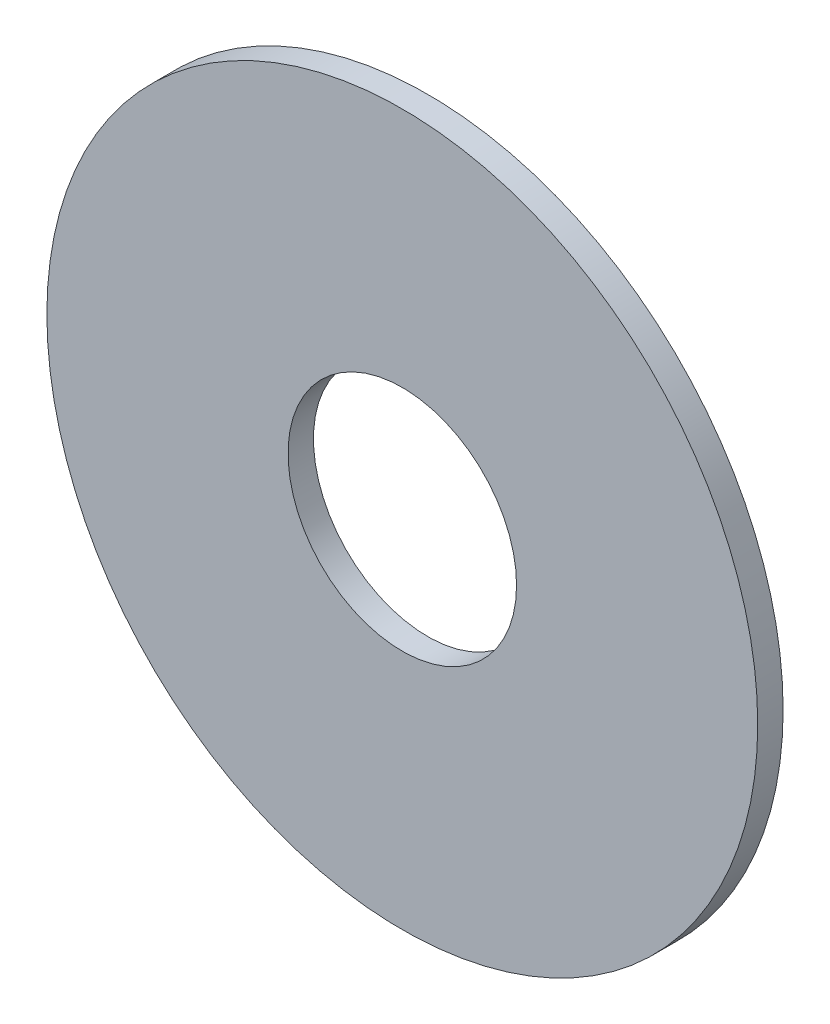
SolidWorks part; units mm, degrees
ref_plane "Front Plane" through (0, 0, 0) normal (0, 0, 1) x (1, 0, 0)
ref_plane "Top Plane" through (0, 0, 0) normal (0, 1, 0) x (1, 0, 0)
ref_plane "Right Plane" through (0, 0, 0) normal (1, 0, 0) x (0, 0, -1)
sketch "Sketch1" plane through (0, 0, 0) normal (0, 0, 1) x (1, 0, 0)
  circle A0 centre (0, 0) radius 88.9
  dimension "D1" = 177.8
extrude "Boss-Extrude1" add sketch "Sketch1" along normal blind 6.35
sketch "Sketch2" plane through (0, 0, 6.35) normal (0, 0, 1) x (1, 0, 0)
  circle A0 centre (0, 0) radius 28.575
  dimension "D1" = 57.15
extrude "Cut-Extrude1" cut sketch "Sketch2" against normal blind 6.35 contours A0
